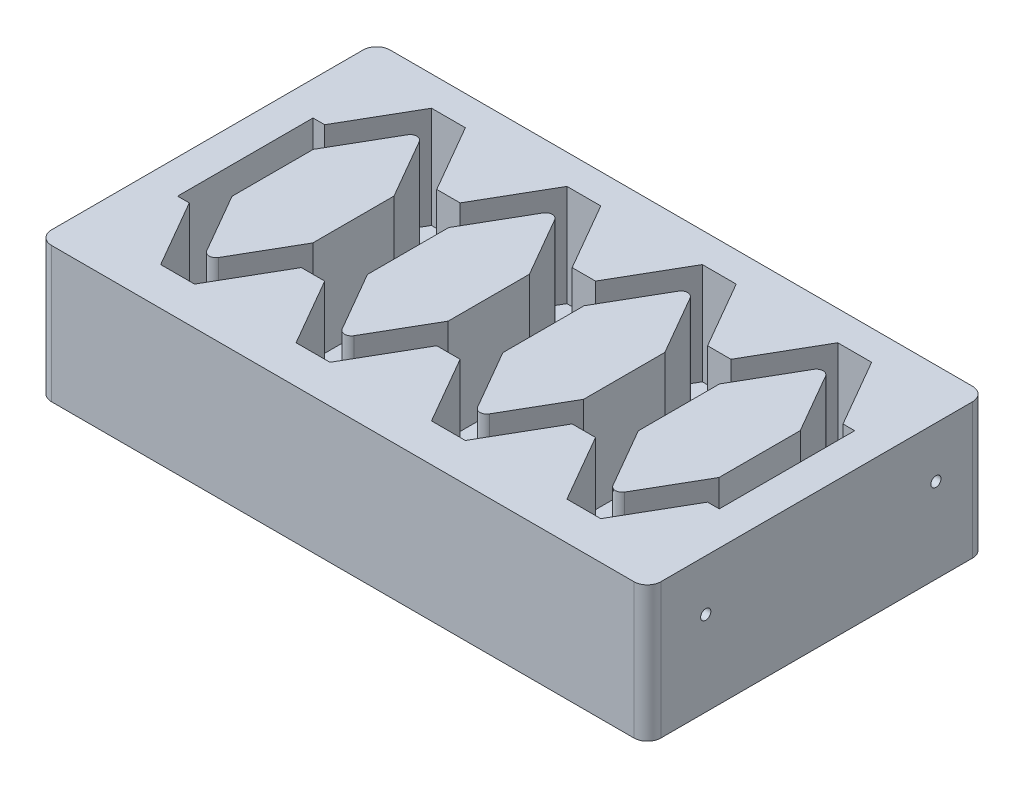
SolidWorks part; units mm, degrees
ref_plane "Front" through (0, 0, 0) normal (0, 0, 1) x (1, 0, 0)
ref_plane "Top" through (0, 0, 0) normal (0, 1, 0) x (1, 0, 0)
ref_plane "Right" through (0, 0, 0) normal (1, 0, 0) x (0, 0, -1)
sketch "Sketch1" plane through (0, 0, 0) normal (0, 1, 0) x (1, 0, 0)
  line L1 (0, 24.3879) -> (90, 24.3879)
  line L2 (0, 24.3879) -> (0, -25.6121)
  line L3 (0, -25.6121) -> (90, -25.6121)
  line L4 (90, 24.3879) -> (90, -25.6121)
  dimension "D1" = 90
  dimension "D2" = 50
extrude "Boss-Extrude1" add sketch "Sketch1" along normal blind 20
other "Cavity1"
other "hole-mold-wire<2>@mold-assembly1"
other "hole-mold-wire<1>@mold-assembly1"
other "flexure<1>@mold-assembly1"
other "generic-metric-dowel-pin<1>@mold-assembly1"
fillet "Fillet1" radius 2 4 edges at (0, 10, -24.3879) (90, 10, -24.3879) (90, 10, 25.6121) (0, 10, 25.6121)
